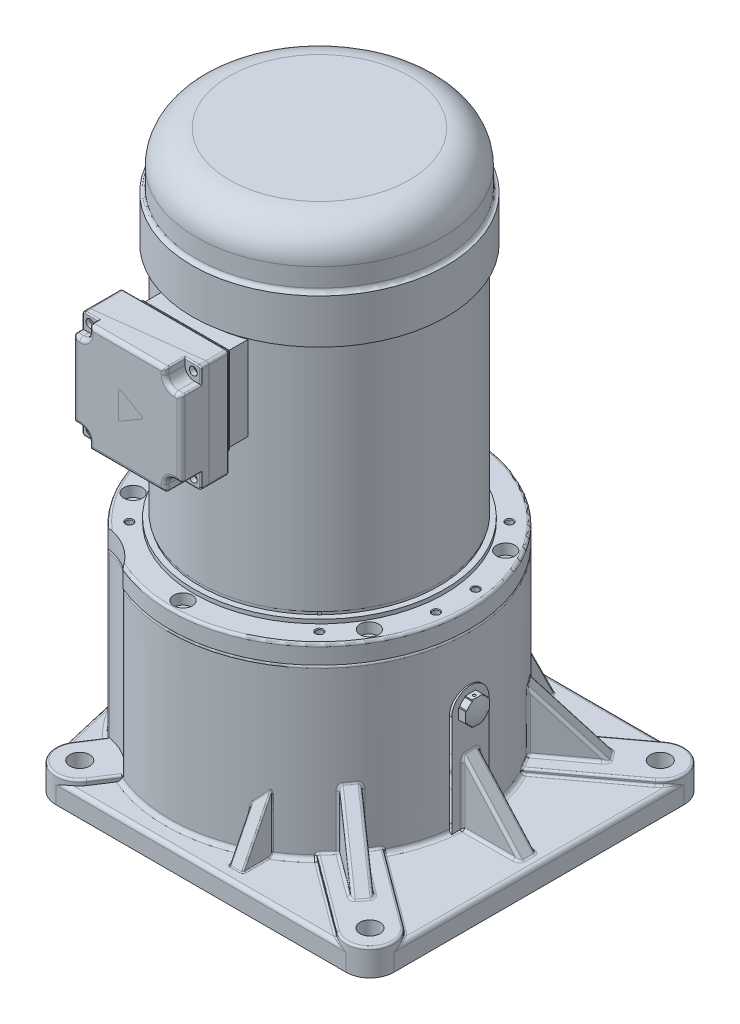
SolidWorks part; units mm, degrees
ref_plane "前视基准面" through (0, 0, 0) normal (0, 0, 1) x (1, 0, 0)
ref_plane "上视基准面" through (0, 0, 0) normal (0, 1, 0) x (1, 0, 0)
ref_plane "右视基准面" through (0, 0, 0) normal (1, 0, 0) x (0, 0, -1)
imported_body "接线盒座-1-surface1"
imported_body "接线盒座-1-surface2"
imported_body "接线盒座-1-surface3"
imported_body "接线盒座-1-surface4"
imported_body "接线盒座-1-surface5"
imported_body "接线盒座-1-surface6"
imported_body "接线盒盖-1-surface1"
imported_body "接线盒盖-1-surface2"
imported_body "15.07.07 40箱盖(新)-1-surface1"
imported_body "15.04.15 40立式箱体新(D版)-1-surface1"
imported_body "透气塞-1-surface1"
sketch "草图1" plane through (0, -158.7491, 0) normal (0, 1, 0) x (1, 0, 0)
  circle A0 centre (164.9227, 82.3308) radius 91
extrude "凸台-拉伸1" add sketch "草图1" along normal blind 176.5
sketch "草图2" plane through (0, 17.7509, 0) normal (0, 1, 0) x (1, 0, 0)
  circle A0 centre (164.9227, 82.3308) radius 96
extrude "凸台-拉伸2" add sketch "草图2" along normal blind 33.5
sketch "草图3" plane through (0, 51.2509, 0) normal (0, 1, 0) x (1, 0, 0)
  circle A0 centre (164.9227, 82.3308) radius 93
extrude "凸台-拉伸3" add sketch "草图3" along normal blind 42
fillet "圆角1" radius 25 1 edges at (164.9227, 93.2509, 10.6692)
fillet "圆角2" radius 3 1 edges at (164.9227, 51.2509, 10.6692)
